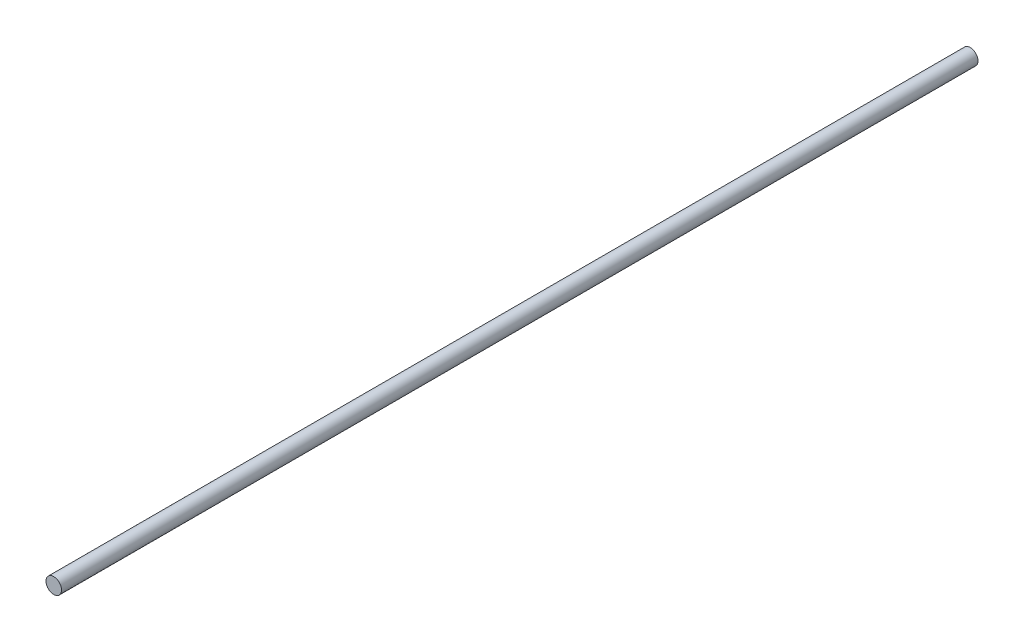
SolidWorks part; units mm, degrees
ref_plane "Plan de face" through (0, 0, 0) normal (0, 0, 1) x (1, 0, 0)
ref_plane "Plan de dessus" through (0, 0, 0) normal (0, 1, 0) x (1, 0, 0)
ref_plane "Plan de droite" through (0, 0, 0) normal (1, 0, 0) x (0, 0, -1)
sketch "Esquisse1" plane through (0, 0, 0) normal (0, 0, 1) x (1, 0, 0)
  circle A0 centre (0, 0) radius 0.5
  dimension "D1" = 1
extrude "Extrusion1" add sketch "Esquisse1" along normal blind 59
